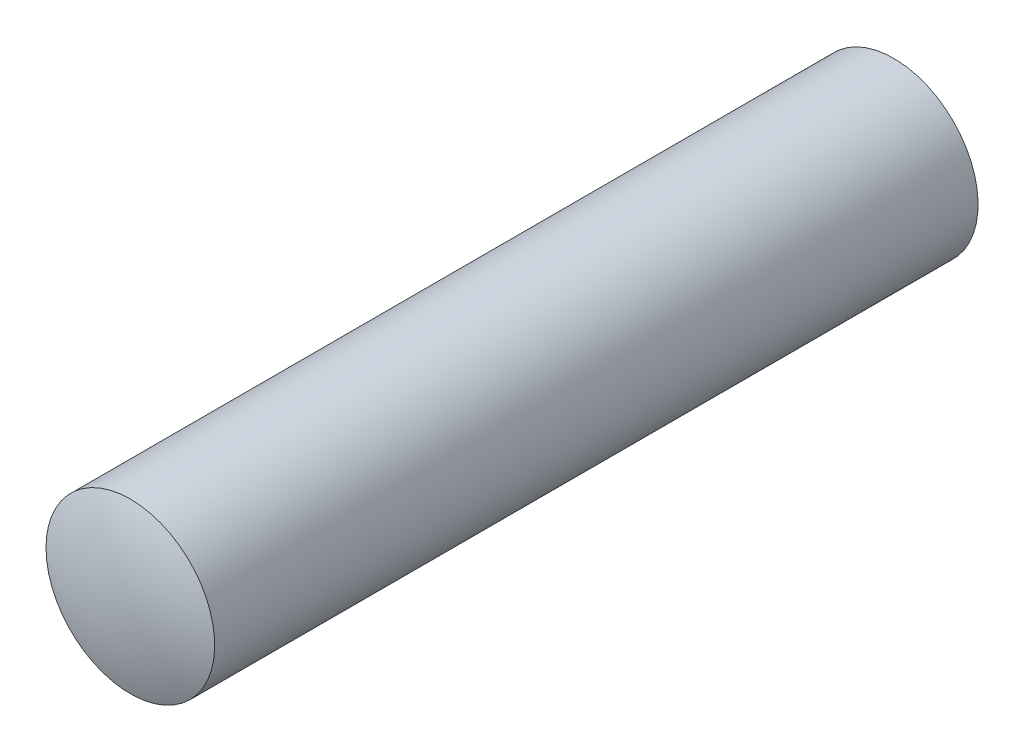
SolidWorks part; units mm, degrees
ref_plane "正面" through (0, 0, 0) normal (0, 0, 1) x (1, 0, 0)
ref_plane "平面" through (0, 0, 0) normal (0, 1, 0) x (1, 0, 0)
ref_plane "右側面" through (0, 0, 0) normal (1, 0, 0) x (0, 0, -1)
sketch "ｽｹｯﾁ1" plane through (0, 0, 0) normal (0, 0, 1) x (1, 0, 0)
  circle A0 centre (0, 0) radius 7.9
  dimension "D1" = 15.8
extrude "ﾎﾞｽ - 押し出し1" add sketch "ｽｹｯﾁ1" against normal blind 74.5
sketch "s-ヤキバメ" plane through (0, 0, 0) normal (1, 0, 0) x (0, 0, -1)
  line L0 (0, 7.9) -> (0, -7.9) construction
  line L1 (19.5, -21) -> (56.5, -21)
  line L2 (19.5, -21) -> (19.5, 21)
  line L3 (19.5, 21) -> (56.5, 21)
  line L4 (56.5, -21) -> (56.5, 21)
  line L5 (0, 0) -> (74.5, 0) construction
  line L6 (74.5, -7.9) -> (74.5, 7.9) construction
  line L7 (19.5, -13.13) -> (56.5, -13.13)
  line L8 (19.5, -17.5) -> (56.5, -17.5)
  line L9 (19.5, 17.5) -> (56.5, 17.5)
  line L10 (19.5, 13.13) -> (56.5, 13.13)
  point P6 (19.5, 0)
  dimension "D1" = 19.5
  dimension "D2" = 37
  dimension "D3" = 42
  dimension "D4" = 35
  dimension "D5" = 7.87
sketch "s-先端輪郭1" plane through (0, 0, 0) normal (1, 0, 0) x (0, 0, -1)
  line L0 (1.5, 7.9) -> (1.5, -7.9) construction
  line L1 (74.5, 7.9) -> (0, 7.9) construction
  line L2 (0, -7.9) -> (74.5, -7.9) construction
  line L3 (0, 7.9) -> (0, -7.9) construction
  arc A0 (1.5, -7.9) -> (1.5, 7.9) centre (21.5533, 0) cw
  dimension "D1" = 1.5
sketch "s-先端輪郭2" plane through (0, 0, 0) normal (1, 0, 0) x (0, 0, -1)
  line L0 (73, 7.9) -> (73, -7.9) construction
  line L1 (74.5, 7.9) -> (0, 7.9) construction
  line L2 (0, -7.9) -> (74.5, -7.9) construction
  line L3 (74.5, -7.9) -> (74.5, 7.9) construction
  arc A0 (73, 7.9) -> (73, -7.9) centre (52.9467, 0) cw
  dimension "D1" = 1.5
sketch "ｽｹｯﾁ5" plane through (0, 0, 0) normal (1, 0, 0) x (0, 0, -1)
  arc A0 (1.5, 7.9) -> (1.5, -7.9) centre (21.5533, 0) ccw construction
  arc A1 (0, 0) -> (1.5, -7.9) centre (21.5533, 0) ccw
other "ｶｯﾄ-回転-薄板1" parameters "D1"=360, "D3"=10, "D4"=10, "D7"=0
sketch "ｽｹｯﾁ6" plane through (0, 0, 0) normal (1, 0, 0) x (0, 0, -1)
  arc A0 (73, -7.9) -> (73, 7.9) centre (52.9467, 0) ccw construction
  arc A1 (73, -7.9) -> (74.5, 0) centre (52.9467, 0) ccw
other "ｶｯﾄ-回転-薄板2" parameters "D1"=360, "D3"=10, "D4"=10, "D7"=0
